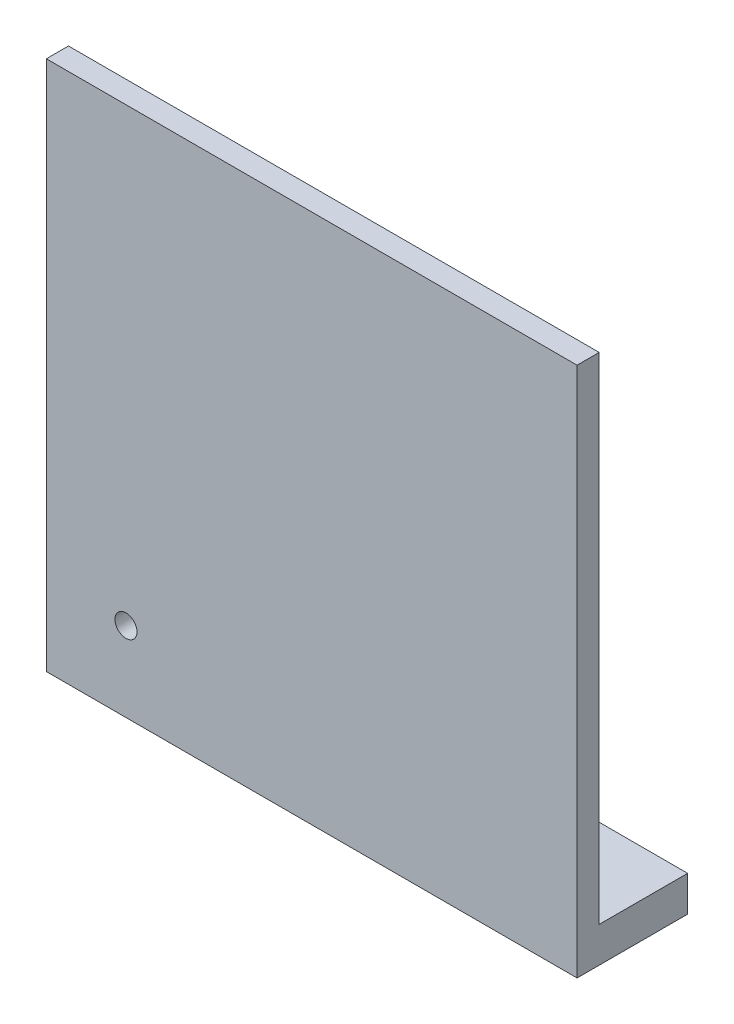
SolidWorks part; units mm, degrees
ref_plane "正面" through (0, 0, 0) normal (0, 0, 1) x (1, 0, 0)
ref_plane "平面" through (0, 0, 0) normal (0, 1, 0) x (1, 0, 0)
ref_plane "右側面" through (0, 0, 0) normal (1, 0, 0) x (0, 0, -1)
sketch "ｽｹｯﾁ1" plane through (0, 0, 0) normal (0, 0, 1) x (1, 0, 0)
  line L1 (0, 0) -> (1200, 0)
  line L2 (0, 0) -> (0, 1200)
  line L3 (0, 1200) -> (1200, 1200)
  line L4 (1200, 0) -> (1200, 1200)
  dimension "D1" = 1200
  dimension "D2" = 1200
extrude "押し出し1" add sketch "ｽｹｯﾁ1" against normal blind 50
sketch "ｽｹｯﾁ2" plane through (0, 0, -50) normal (0, 0, -1) x (-1, 0, 0)
  line L0 (0, 1200) -> (0, 0) construction
  line L1 (-1200, 0) -> (0, 0)
  line L2 (-1200, 0) -> (-1200, 80)
  line L3 (-1200, 80) -> (0, 80)
  line L4 (0, 0) -> (0, 80)
  dimension "D1" = 80
extrude "押し出し2" add sketch "ｽｹｯﾁ2" along normal blind 200
sketch "ｽｹｯﾁ3" plane through (0, 0, 0) normal (0, 0, 1) x (1, 0, 0)
  line L0 (0, 1200) -> (0, 0) construction
  line L3 (0, 0) -> (1200, 0) construction
  circle A0 centre (180, 180) radius 25
  dimension "D1" = 50
  dimension "D2" = 180
  dimension "D3" = 180
extrude "押し出し3" cut sketch "ｽｹｯﾁ3" against normal through all
